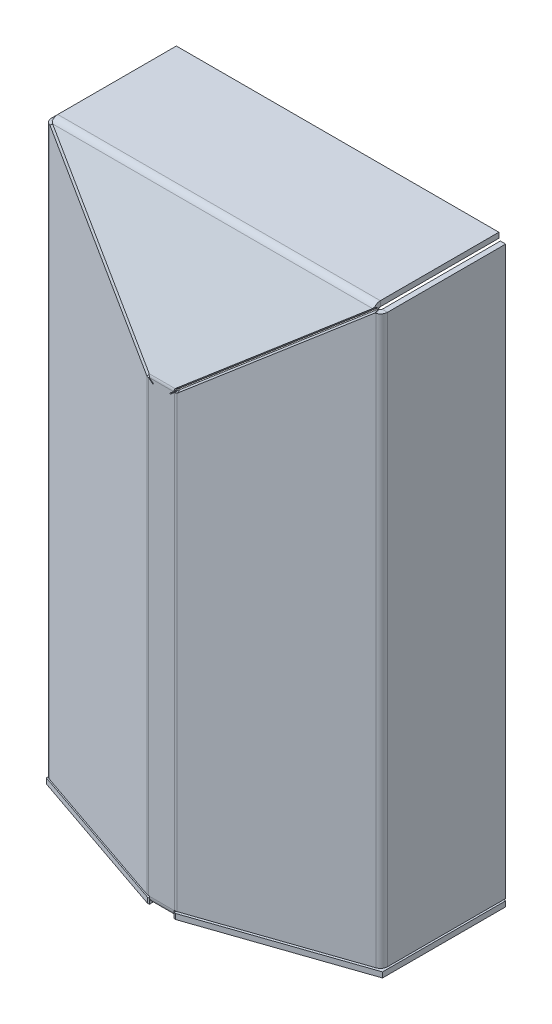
SolidWorks part; units mm, degrees
ref_plane "Ebene1" through (0, 0, 0) normal (0, 0, 1) x (1, 0, 0)
ref_plane "Ebene2" through (0, 0, 0) normal (0, 1, 0) x (1, 0, 0)
ref_plane "Ebene3" through (0, 0, 0) normal (1, 0, 0) x (0, 0, -1)
sketch "Skizze1" plane through (0, 0, 0) normal (0, 0, 1) x (1, 0, 0)
  line L1 (0, 0) -> (191, 0)
  line L2 (0, 0) -> (0, 330)
  line L3 (0, 330) -> (191, 330)
  line L4 (191, 0) -> (191, 330)
  dimension "D1" = 191
  dimension "D2" = 330
extrude "Linear austragen1" add sketch "Skizze1" against normal blind 100
sketch "Skizze2" plane through (191, 0, 0) normal (1, 0, 0) x (0, 0, -1)
  line L0 (0, 330) -> (30, 330)
  line L1 (100, 330) -> (0, 330) construction
  line L2 (30, 330) -> (0, 260)
  line L3 (0, 0) -> (0, 330) construction
  line L4 (0, 260) -> (0, 330)
  dimension "D1" = 70
  dimension "D2" = 30
extrude "Schnitt-Linear austragen1" cut sketch "Skizze2" against normal up to next
sketch "Skizze4" plane through (0, 0, 0) normal (0, -1, 0) x (1, 0, 0)
  line L0 (0, 0) -> (87.5, 0)
  line L1 (0, 0) -> (191, 0) construction
  line L2 (87.5, 0) -> (0, -30)
  line L3 (0, -100) -> (0, 0) construction
  line L4 (0, -30) -> (0, 0)
  line L5 (95.5, 7.1429) -> (95.5, -104.4379) construction
  line L6 (103.5, 0) -> (191, -30)
  line L7 (191, -30) -> (191, 0)
  line L8 (191, 0) -> (103.5, 0)
  line L9 (191, -100) -> (191, 0) construction
  dimension "D1" = 8
  dimension "D2" = 30
extrude "Schnitt-Linear austragen2" cut sketch "Skizze4" against normal up to surface (330 mm away)
shell "Wandung2" thickness 3
sketch "Skizze8" plane through (783.4054, 0, -100) normal (0, 0, 1) x (1, 0, 0)
  line L8 (-687.9054, 330) -> (-687.9054, 259.3842) construction
  line L9 (-592.4054, 330) -> (-783.4054, 330) construction
  line L10 (-596.2859, 327) -> (-683.3056, 257.3842)
  line L13 (-596.2859, 327) -> (-596.2859, 330)
  line L14 (-596.2859, 330) -> (-592.4054, 330)
  line L15 (-592.4054, 330) -> (-592.4054, 326.1195)
  line L16 (-592.4054, 326.1195) -> (-595.4054, 326.1195)
  line L17 (-593.9679, 328.5342) -> (-680.4054, 259.3842) construction
  line L18 (-695.4054, 259.3842) -> (-680.4054, 259.3842) construction
  line L19 (-595.9735, 326.6096) -> (-682.9933, 256.9938)
  line L20 (-683.3056, 257.3842) -> (-682.9933, 256.9938)
  line L21 (-595.4054, 326.1195) -> (-595.9735, 326.6096)
  line L22 (-779.5249, 327) -> (-779.5249, 330)
  line L23 (-779.5249, 327) -> (-692.5052, 257.3842)
  line L24 (-692.5052, 257.3842) -> (-692.8176, 256.9938)
  line L25 (-779.8373, 326.6096) -> (-692.8176, 256.9938)
  line L26 (-780.4054, 326.1195) -> (-779.8373, 326.6096)
  line L27 (-783.4054, 326.1195) -> (-780.4054, 326.1195)
  line L28 (-783.4054, 330) -> (-783.4054, 326.1195)
  line L29 (-779.5249, 330) -> (-783.4054, 330)
  line L30 (-680.4054, 259.3842) -> (-680.4054, 3) construction
  line L31 (-592.4054, 0) -> (-592.4054, 330) construction
  line L32 (-592.4054, 330) -> (-783.4054, 330) construction
  line L33 (-595.8857, 327) -> (-680.4054, 259.3842) construction
  line L34 (-595.4054, 327) -> (-780.4054, 327) construction
  line L35 (-595.4054, 327) -> (-595.4054, 3) construction
  line L36 (-783.4054, 330) -> (-783.4054, 0) construction
  line L37 (-783.4054, 4.1) -> (-694.9054, 4.1)
  line L38 (-783.4054, 4.1) -> (-783.4054, 3)
  line L39 (-783.4054, 3) -> (-694.9054, 3)
  line L40 (-694.9054, 4.1) -> (-694.9054, 3)
  line L41 (-780.4054, 3) -> (-595.4054, 3) construction
  line L42 (-695.4054, 259.3842) -> (-695.4054, 3) construction
  line L44 (-592.4054, 4.1) -> (-592.4054, 3)
  line L45 (-592.4054, 4.1) -> (-680.9054, 4.1)
  line L46 (-680.9054, 4.1) -> (-680.9054, 3)
  line L47 (-592.4054, 3) -> (-680.9054, 3)
  dimension "D1" = 2
  dimension "D2" = 0.5
  dimension "D3" = 1.1
  dimension "D4" = 0.5
extrude "Schnitt-Linear austragen5" cut sketch "Skizze8" along normal through all
sheet metal parameters "Blech2" parameters "D1"=1, "Dicke"=3
bend "Biegung-Winkel12" bend angle 90 parameters "D1"=0, "D5"=1
flatten bends "Abwickeln2" parameters "D1"=0
sketch "Skizze-Winkel2" plane through (0, 0, -3) normal (0, 0, -1) x (-1, 0, 0)
  line L0 (-102.5, 2.0365) -> (-88.5, 2.0365) construction
  line L1 (-87.7538, 4.1) -> (-87.7538, 259.0641) construction
  line L2 (3.1859, 4.1) -> (3.1859, 326.1195) construction
  line L3 (-103.2462, 259.0641) -> (-103.2462, 4.1) construction
  line L4 (-194.1859, 326.1195) -> (-194.1859, 4.1) construction
  line L5 (-88.4002, 259.6851) -> (-102.5998, 259.6851) construction
  line L6 (-3.8805, 334.3477) -> (-187.1195, 334.3477) construction
bend "Biegung-Winkel8" bend angle 18.925 parameters "D1"=0, "D5"=4
bend "Biegung-Winkel9" bend angle 71.075 parameters "D1"=0, "D5"=5
bend "Biegung-Winkel10" bend angle 71.075 parameters "D1"=0, "D5"=3
bend "Biegung-Winkel11" bend angle 18.925 parameters "D1"=0, "D5"=2
bend "Biegung-Winkel13" bend angle 23.199 parameters "D1"=0, "D5"=6
bend "Biegung-Winkel14" bend angle 66.801 parameters "D1"=0, "D5"=7
process bends "Abbiegen2" parameters "D1"=0
sketch "Abwicklung-Skizze2" plane through (0, 0, -3) normal (0, 0, -1) x (-1, 0, 0)
flat pattern "Abwicklung2"
sketch "Biegung-Linien2" plane through (0, 0, -3) normal (0, 0, -1) x (-1, 0, 0)
  line L0 (-187.1195, 334.3477) -> (-3.8805, 334.3477) construction
  line L1 (-102.5894, 259.6851) -> (-88.4106, 259.6851) construction
  line L2 (-194.1859, 4.1) -> (-194.1859, 326.1195) construction
  line L3 (-103.2462, 4.1) -> (-103.2462, 259.0605) construction
  line L4 (3.1859, 326.1195) -> (3.1859, 4.1) construction
  line L5 (-87.7538, 259.0605) -> (-87.7538, 4.1) construction
  line L6 (-88.5, 2.0365) -> (-102.5, 2.0365) construction
  line L7 (-187.1195, 334.3477) -> (-3.8805, 334.3477) construction
  line L8 (-102.5894, 259.6851) -> (-88.4106, 259.6851) construction
  line L9 (-194.1859, 4.1) -> (-194.1859, 326.1195) construction
  line L10 (-103.2462, 4.1) -> (-103.2462, 259.0605) construction
  line L11 (3.1859, 326.1195) -> (3.1859, 4.1) construction
  line L12 (-87.7538, 259.0605) -> (-87.7538, 4.1) construction
  line L13 (-88.5, 2.0365) -> (-102.5, 2.0365) construction
bend of the flat pattern "Abwickeln-<Biegung-Winkel8>1"
bend of the flat pattern "Abwickeln-<Biegung-Winkel9>1"
bend of the flat pattern "Abwickeln-<Biegung-Winkel10>1"
bend of the flat pattern "Abwickeln-<Biegung-Winkel11>1"
bend of the flat pattern "Abwickeln-<Biegung-Winkel12>1"
bend of the flat pattern "Abwickeln-<Biegung-Winkel13>1"
bend of the flat pattern "Abwickeln-<Biegung-Winkel14>1"
